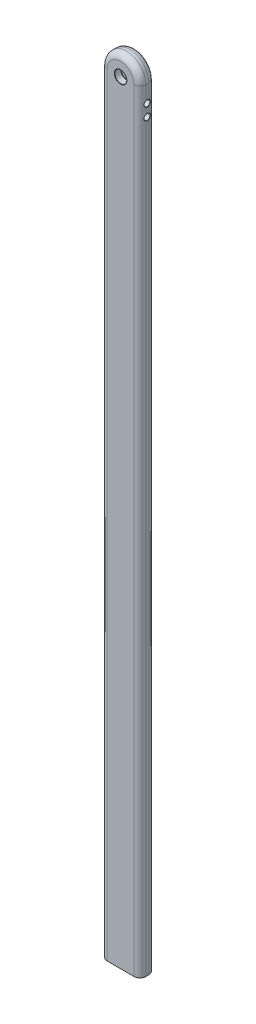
SolidWorks part; units mm, degrees
ref_plane "Спереди" through (0, 0, 0) normal (0, 0, 1) x (1, 0, 0)
ref_plane "Сверху" through (0, 0, 0) normal (0, 1, 0) x (1, 0, 0)
ref_plane "Справа" through (0, 0, 0) normal (1, 0, 0) x (0, 0, -1)
sketch "Эскиз1" plane through (0, 0, 0) normal (0, 0, 1) x (1, 0, 0)
  line L0 (-32.5, 0) -> (-32.5, -1297.5)
  line L1 (-32.5, -1297.5) -> (32.5, -1297.5)
  line L2 (32.5, -1297.5) -> (32.5, 0)
  arc A0 (32.5, 0) -> (-32.5, 0) centre (0, 0) ccw
  dimension "D1" = 65
  dimension "D2" = 1297.5
extrude "Бобышка-Вытянуть1" add sketch "Эскиз1" along normal mid plane 25
fillet "Скругление1" radius 10 6 edges at (-32.5, -648.75, -12.5) (32.5, -648.75, -12.5) (0, 32.5, -12.5) (32.5, -648.75, 12.5) (-32.5, -648.75, 12.5) (0, 32.5, 12.5)
sketch "Эскиз2" plane through (0, 0, 12.5) normal (0, 0, 1) x (1, 0, 0)
  circle A0 centre (0, 0) radius 10
  dimension "D1" = 20
extrude "Вырез-Вытянуть1" cut sketch "Эскиз2" against normal blind 11
sketch "Эскиз3" plane through (0, -1297.5, 0) normal (0, -1, 0) x (1, 0, 0)
  line L0 (-19, 0) -> (0, 0) construction
  line L1 (0, 0) -> (19, 0) construction
  circle A0 centre (0, 0) radius 5
  circle A1 centre (19, 0) radius 5
  circle A2 centre (-19, 0) radius 5
  dimension "D1" = 10
  dimension "D2" = 19
extrude "Вырез-Вытянуть2" cut sketch "Эскиз3" against normal blind 35
sketch "Эскиз4" plane through (-32.5, 0, 0) normal (-1, 0, 0) x (0, 0, 1)
  line L0 (2.5, 32.5) -> (-2.5, 32.5) construction
  circle A0 centre (0, -28.5) radius 5
  circle A1 centre (0, -48.5) radius 5
  dimension "D2" = 10
  dimension "D1" = 20
  dimension "D3" = 61
sketch "Эскиз5" plane through (32.5, 0, 0) normal (1, 0, 0) x (0, 0, -1)
  circle A0 centre (0, -28.5) radius 5 construction
  circle A1 centre (0, -48.5) radius 5 construction
  circle A2 centre (0, -28.5) radius 5
  circle A3 centre (0, -48.5) radius 5
extrude "Вырез-Вытянуть3" cut sketch "Эскиз5" against normal blind 30
chamfer "Фаска1" distance 0.5 angle 45 26 edges at (19, -1297.5, -5) (19, -1262.5, -5) (0, -1297.5, -5) (0, -1262.5, -5) (-19, -1297.5, -5) (-19, -1262.5, -5) (2.5, -43.5, 0) (32.5, -43.5, 0) (32.5, -53.5, 0) (32.1837, -48.2776, 4.9951) (32.1826, -48.5656, -4.9996) (2.5, -23.5, 0) (32.5, -23.5, 0) (32.5, -33.5, 0) (32.1837, -28.2776, 4.9951) (32.1837, -28.7224, -4.9951) (10, 0, 12.5) (10, 0, 1.5) (0, -1297.5, -12.5) (-29.5711, -1297.5, -9.5711) (29.5711, -1297.5, -9.5711) (-32.5, -1297.5, 0) (32.5, -1297.5, 0) (-29.5711, -1297.5, 9.5711) (29.5711, -1297.5, 9.5711) (0, -1297.5, 12.5)
